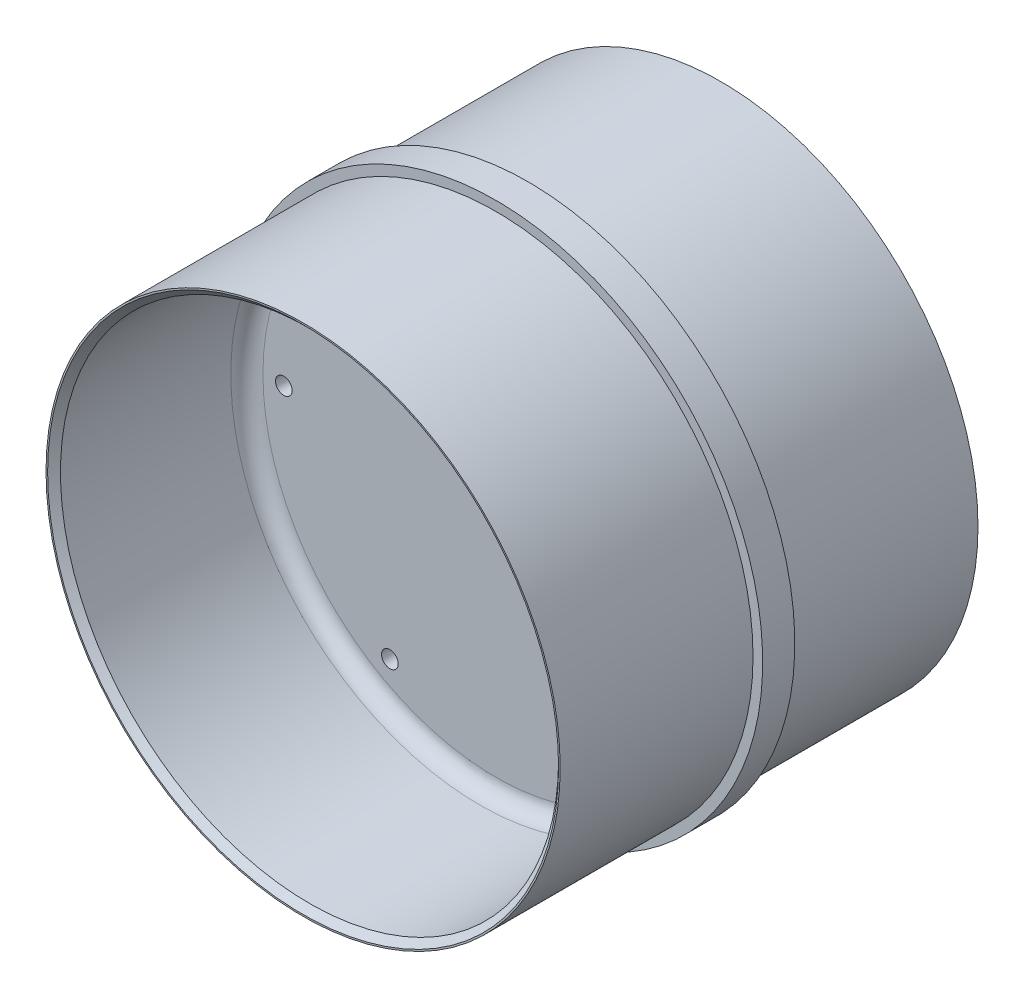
SolidWorks part; units mm, degrees
ref_plane "Front Plane" through (0, 0, 0) normal (0, 0, 1) x (1, 0, 0)
ref_plane "Top Plane" through (0, 0, 0) normal (0, 1, 0) x (1, 0, 0)
ref_plane "Right Plane" through (0, 0, 0) normal (1, 0, 0) x (0, 0, -1)
sketch "Sketch2" plane through (0, 0, 0) normal (1, 0, 0) x (0, 0, -1)
  line L0 (-5, 0) -> (-5, 77.5)
  line L2 (-65, 77.5) -> (-65, 80)
  line L3 (-65, 80) -> (-5, 80)
  line L4 (-5, 80) -> (-5, 83)
  line L5 (-5, 83) -> (5, 83)
  line L6 (0, 0) -> (0, 120.0745) construction
  line L7 (-5, 77.5) -> (-65, 77.5)
  line L8 (5, 77.5) -> (65, 77.5)
  line L9 (65, 77.5) -> (65, 80)
  line L10 (5, 80) -> (5, 83)
  line L11 (65, 80) -> (5, 80)
  line L12 (-5, 0) -> (5, 0)
  line L14 (5, 0) -> (5, 77.5)
  point P2 (0, 0)
  point P9 (0, 0)
  point P11 (0, 0)
  point P16 (0, 83)
  point P18 (5, 77.3113)
  point P20 (0, 0)
  point P21 (0, 0)
  point P22 (0, 0)
  dimension "D1" = 80
  dimension "D2" = 10
  dimension "D3" = 10
  dimension "D4" = 3
  dimension "D5" = 2.5
  dimension "D6" = 60
ref_axis "Axis1" through (0, 0, -77) along (0, 0, 1)
revolve "Revolve1" add sketch "Sketch2" angle 360 about axis through (0, 0, -77) along (0, 0, 1)
chamfer "Chamfer1" distance 2 angle 45 1 edges at (-77.5, 0, -65)
chamfer "Chamfer2" distance 2 angle 45 1 edges at (-77.5, 0, 65)
hole_wizard "#6 (0.204) Diameter Hole1" positions "Sketch4" profile "Sketch5" hole size "#6" standard "ANSI Inch"
sketch "Sketch4" plane through (0, 0, 5) normal (0, 0, 1) x (1, 0, 0)
  line L0 (0, 0) -> (0, 39.3331) construction
  line L2 (0, 0) -> (-33, 57.1577) construction
  circle A0 centre (0, 0) radius 66
  point P5 (-33, 57.1577)
  dimension "D2" = 132
  dimension "D1" = 30
sketch "Sketch5" plane through (-33, 57.1577, 5) normal (1, 0, 0) x (0, -1, 0)
  line L0 (0, 0) -> (0, 11.5557)
  line L1 (0, 11.5557) -> (2.5908, 9.999)
  line L2 (2.5908, 9.999) -> (2.5908, 0)
  line L5 (2.5908, 0) -> (0, 0)
  line L10 (0, 11.5557) -> (-2.5908, 9.999) construction
  line L11 (0, -6.35) -> (0, 107.95) construction
  dimension "Hole Dia." = 5.1816
  dimension "Hole Depth" = 9.999
  dimension "Drill Angle" = 118
pattern_circular "CirPattern1" count 6 over 360 about axis through (0, 0, 0) along (0, 0, 1) of "#6 (0.204) Diameter Hole1"
fillet "Fillet2" radius 5 1 edges at (-77.5, 0, -5)
fillet "Fillet3" radius 5 1 edges at (-77.5, 0, 5)
